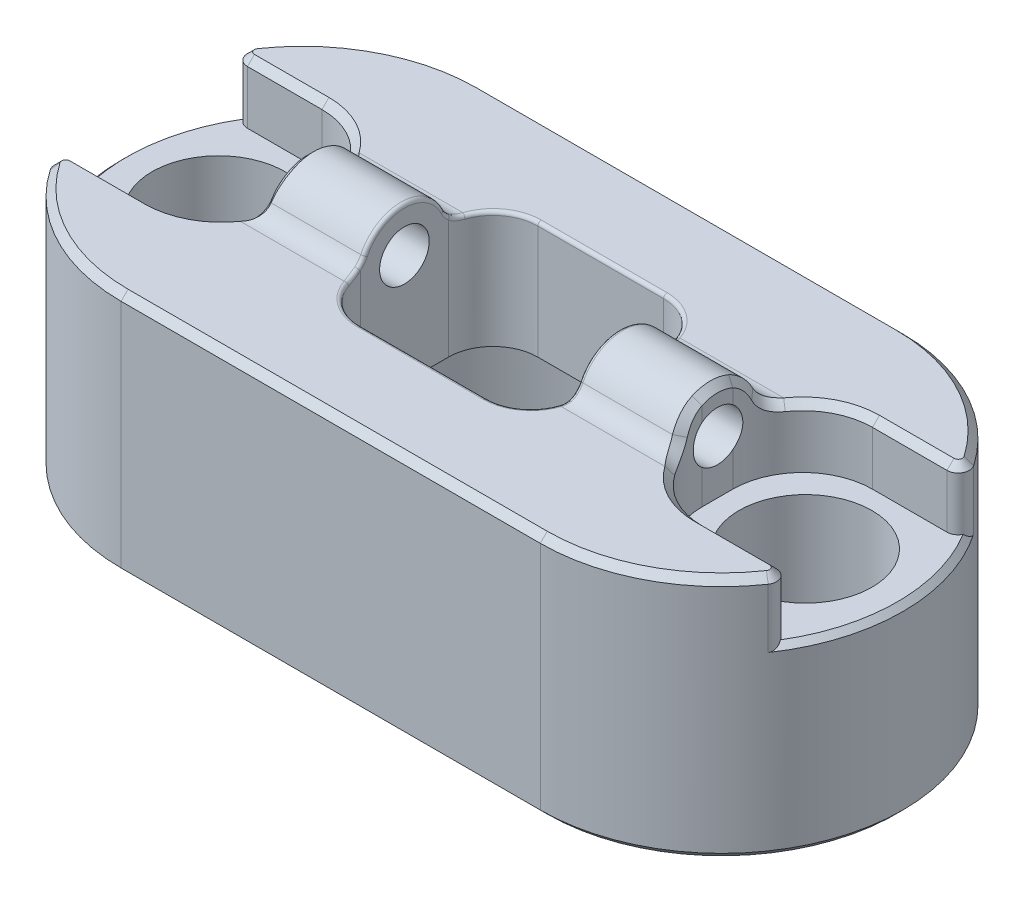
SolidWorks part; units mm, degrees
ref_plane "Front Plane" through (0, 0, 0) normal (0, 0, 1) x (1, 0, 0)
ref_plane "Top Plane" through (0, 0, 0) normal (0, 1, 0) x (1, 0, 0)
ref_plane "Right Plane" through (0, 0, 0) normal (1, 0, 0) x (0, 0, -1)
sketch "Sketch1" plane through (0, 0, 0) normal (1, 0, 0) x (0, 0, -1)
  line L0 (0, 0) -> (0, 11.8405) construction
  line L1 (-12.975, 0) -> (12.975, 0)
  line L2 (-12.975, 0) -> (-12.975, 17.53)
  line L3 (-12.975, 17.53) -> (-4.2485, 17.53)
  line L4 (12.975, 0) -> (12.975, 17.53)
  line L6 (4.2485, 17.53) -> (12.975, 17.53)
  circle A3 centre (0, 17.04) radius 1.775 construction
  arc A4 (2.8745, 18.4) -> (-2.8745, 18.4) centre (0, 17.04) ccw
  arc A5 (2.8745, 18.4) -> (4.2485, 17.53) centre (4.2485, 19.05) ccw
  arc A6 (-4.2485, 17.53) -> (-2.8745, 18.4) centre (-4.2485, 19.05) ccw
  dimension "D3" = 3.18
  dimension "D4" = 1.52
  dimension "D6" = 17.04
  dimension "D7" = 3.55
  dimension "D1" = 25.95
  dimension "D2" = 17.53
extrude "Boss-Extrude1" add sketch "Sketch1" along normal mid plane 55.95
sketch "Sketch2" plane through (0, 0, 0) normal (0, 1, 0) x (1, 0, 0)
  line L8 (15, 12.975) -> (35, 12.975)
  line L18 (35, 12.975) -> (35, -12.975)
  line L19 (35, -12.975) -> (15, -12.975)
  line L20 (27.975, 12.975) -> (-27.975, 12.975) construction
  line L21 (27.975, -12.975) -> (-27.975, -12.975) construction
  line L22 (27.975, 12.975) -> (27.975, 4.2485) construction
  line L23 (0, -11.121) -> (0, 11.121) construction
  line L24 (-35, -12.975) -> (-15, -12.975)
  line L25 (-35, 12.975) -> (-35, -12.975)
  line L26 (-15, 12.975) -> (-35, 12.975)
  arc A5 (15, -12.975) -> (15, 12.975) centre (15, 0) ccw
  arc A6 (-15, -12.975) -> (-15, 12.975) centre (-15, 0) cw
  dimension "D1" = 35
extrude "Cut-Extrude1" cut sketch "Sketch2" along normal blind 38
sketch "Sketch4" plane through (0, 0, 0) normal (1, 0, 0) x (0, 0, -1)
  line L1 (-12.975, 0) -> (12.975, 0) construction
  circle A0 centre (0, 17.04) radius 1.775
  dimension "D1" = 3.55
  dimension "D2" = 17.04
extrude "Cut-Extrude2" cut sketch "Sketch4" against normal through all both and the other way through all
ref_plane "Plane2" through (0, 20.22, 0) normal (0, 1, 0) x (1, 0, 0)
sketch "Sketch5" plane through (0, 20.22, 0) normal (0, 1, 0) x (1, 0, 0)
  line L0 (0, 6.35) -> (0, -6.35) construction
  line L1 (-4.5, 6.35) -> (4.5, 6.35)
  line L2 (-7.7, 3.15) -> (-7.7, -3.15)
  line L3 (-4.5, -6.35) -> (4.5, -6.35)
  line L4 (7.7, 3.15) -> (7.7, -3.15)
  line L5 (-7.7, 0) -> (7.7, 0) construction
  arc A0 (-4.5, 6.35) -> (-7.7, 3.15) centre (-4.5, 3.15) ccw
  arc A1 (-4.5, -6.35) -> (-7.7, -3.15) centre (-4.5, -3.15) cw
  arc A2 (4.5, -6.35) -> (7.7, -3.15) centre (4.5, -3.15) ccw
  arc A3 (7.7, 3.15) -> (4.5, 6.35) centre (4.5, 3.15) ccw
  point P11 (-7.7, 6.35)
  point P14 (-7.7, -6.35)
  point P19 (7.7, 6.35)
  dimension "D3" = 3.2
  dimension "D1" = 12.7
  dimension "D2" = 15.4
extrude "Cut-Extrude3" cut sketch "Sketch5" against normal blind 40
sketch "Sketch6" plane through (0, 0, 0) normal (0, -1, 0) x (1, 0, 0)
  circle A0 centre (0, 0) radius 10.25
  dimension "D1" = 20.5
extrude "Cut-Extrude4" cut sketch "Sketch6" against normal blind 9.16
sketch "Sketch7" plane through (0, 0, 0) normal (0, -1, 0) x (1, 0, 0)
  line L0 (-27.975, 0) -> (-7.7, 0) construction
  line L2 (-13.6069, 0) -> (-26.2986, 0) construction
  circle A0 centre (-21, 0) radius 4.76
  circle A1 centre (21, 0) radius 4.76
  dimension "D1" = 42
  dimension "D3" = 9.52
  dimension "D2" = 21
extrude "Cut-Extrude5" cut sketch "Sketch7" against normal through all
ref_plane "Plane3" through (0, 13.2, 0) normal (0, -1, 0) x (-1, 0, 0)
sketch "Sketch8" plane through (0, 13.2, 0) normal (0, -1, 0) x (-1, 0, 0)
  line L0 (31.75, 6.1) -> (31.75, -6.1)
  line L1 (31.75, -6.1) -> (19.7, -6.1)
  line L2 (14.7, -1.1) -> (14.7, 1.1)
  line L3 (19.7, 6.1) -> (31.75, 6.1)
  line L4 (0, 0) -> (0, -12.975) construction
  line L5 (-15, -12.975) -> (15, -12.975) construction
  line L6 (0, 0) -> (21.3919, 0) construction
  line L7 (-31.75, -6.1) -> (-19.7, -6.1)
  line L8 (-31.75, 6.1) -> (-31.75, -6.1)
  line L9 (-19.7, 6.1) -> (-31.75, 6.1)
  line L10 (-14.7, -1.1) -> (-14.7, 1.1)
  arc A0 (19.7, -6.1) -> (14.7, -1.1) centre (19.7, -1.1) cw
  arc A1 (14.7, 1.1) -> (19.7, 6.1) centre (19.7, 1.1) cw
  arc A2 (-19.7, -6.1) -> (-14.7, -1.1) centre (-19.7, -1.1) ccw
  arc A3 (-14.7, 1.1) -> (-19.7, 6.1) centre (-19.7, 1.1) ccw
  dimension "D3" = 5
  dimension "D1" = 12.2
  dimension "D2" = 14.7
  dimension "D4" = 31.75
extrude "Cut-Extrude6" cut sketch "Sketch8" against normal through all
fillet "Fillet2" radius 0.8 4 edges at (-26.4517, 15.365, -6.1) (-26.4517, 15.365, 6.1) (26.4517, 15.365, 6.1) (26.4517, 15.365, -6.1)
chamfer "Chamfer1" distance 0.4 angle 45 2 edges at (27.975, 13.2, 0) (-27.975, 13.2, 0)
chamfer "Chamfer2" distance 0.5 angle 45 28 edges at (22.3655, 17.53, 6.1) (17.5486, 17.53, 5.6135) (-22.3655, 17.53, 6.1) (-17.5486, 17.53, 5.6135) (0, 17.53, 12.975) (21.0391, 17.53, 11.4839) (-21.0391, 17.53, 11.4839) (-15.2629, 17.7857, 3.4047) (-14.7441, 19.6868, 1.7627) (-14.7, 20.22, 0) (-14.7755, 19.5398, -1.9655) (-15.2497, 17.8031, -3.3792) (-17.5486, 17.53, -5.6135) (-22.3655, 17.53, -6.1) (15.5058, 17.5911, 3.8219) (14.9148, 18.9401, 2.5499) (14.7, 20.22, 0) (14.7316, 19.7513, -1.6616) (15.2355, 17.823, -3.3513) (22.3655, 17.53, -6.1) (17.5486, 17.53, -5.6135) (21.0391, 17.53, -11.4839) (-21.0391, 17.53, -11.4839) (0, 17.53, -12.975) (25.739, 17.53, 6.5276) (-25.739, 17.53, 6.5276) (25.739, 17.53, -6.5276) (-25.739, 17.53, -6.5276)
fillet "Fillet1" radius 0.25 16 edges at (-6.3337, 17.53, 5.7725) (0, 17.53, 6.35) (6.3337, 17.53, 5.7725) (-6.3337, 17.53, -5.7725) (-7.677, 17.7091, -3.5327) (-7.7, 18.1886, -2.9962) (-7.7, 20.22, 0) (-7.7, 18.1886, 2.9962) (-7.6351, 17.6005, 3.791) (7.677, 17.7091, 3.5327) (7.7, 18.1886, 2.9962) (7.7, 20.22, 0) (7.7, 18.1886, -2.9962) (7.6351, 17.6005, -3.791) (6.3337, 17.53, -5.7725) (0, 17.53, -6.35)
chamfer "Chamfer3" distance 0.5 angle 45 4 edges at (0, 0, -12.975) (27.975, 0, 0) (-27.975, 0, 0) (0, 0, 12.975)
chamfer "Chamfer4" distance 0.25 angle 45 3 edges at (21, 0, -4.76) (0, 0, -10.25) (-21, 0, -4.76)
fillet "Fillet3" radius 0.3 1 edges at (0, 9.16, -10.25)
